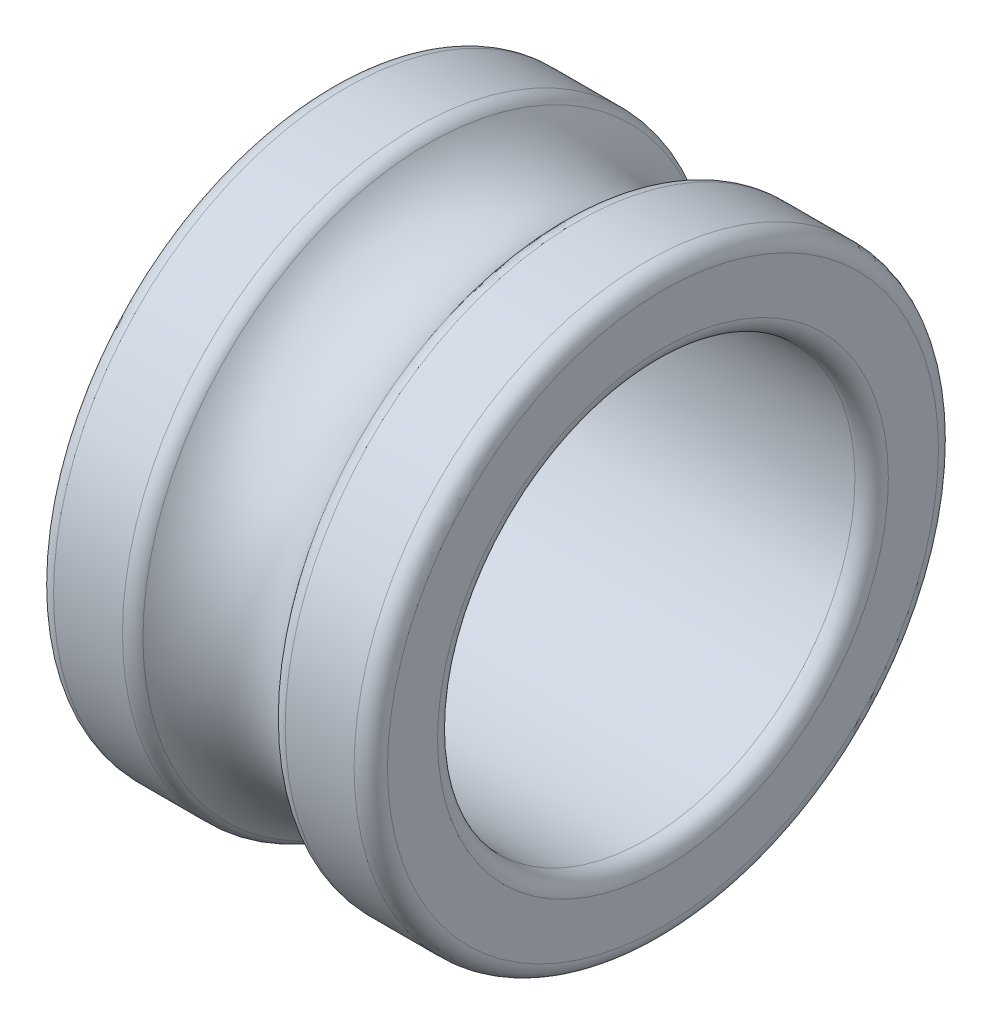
SolidWorks part; units mm, degrees
ref_plane "Plan1" through (0, 0, 0) normal (0, 0, 1) x (1, 0, 0)
ref_plane "Plan2" through (0, 0, 0) normal (0, 1, 0) x (1, 0, 0)
ref_plane "Plan3" through (0, 0, 0) normal (1, 0, 0) x (0, 0, -1)
sketch "Esquisse1" plane through (0, 0, 0) normal (0, 0, 1) x (1, 0, 0)
  line L0 (0, 0) -> (12.8822, 0) construction
  line L1 (0.866, 3.5) -> (2, 3.5)
  line L2 (-2, 2.5) -> (2, 2.5)
  line L3 (-2, 2.5) -> (-2, 3.5)
  line L4 (-2, 3.5) -> (-0.866, 3.5)
  line L5 (2, 2.5) -> (2, 3.5)
  arc A0 (-0.866, 3.5) -> (0.866, 3.5) centre (0, 4) ccw
  dimension "D5" = 1
  dimension "D1" = 2
  dimension "D2" = 4
  dimension "D3" = 2.5
  dimension "D4" = 4
  dimension "D6" = 1
revolve "Révolution1" add sketch "Esquisse1" angle 360 about L0
fillet "Congé1" radius 0.2
